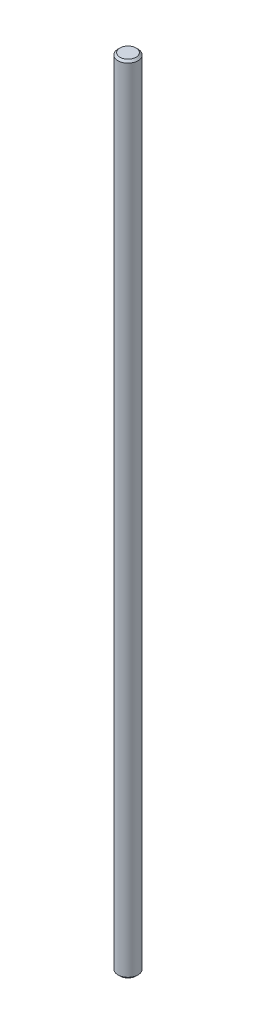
SolidWorks part; units mm, degrees
ref_plane "Front" through (0, 0, 0) normal (0, 0, 1) x (1, 0, 0)
ref_plane "Top" through (0, 0, 0) normal (0, 1, 0) x (1, 0, 0)
ref_plane "Right" through (0, 0, 0) normal (1, 0, 0) x (0, 0, -1)
sketch "Sketch1" plane through (0, 0, 0) normal (0, 1, 0) x (1, 0, 0)
  circle A0 centre (0, 0) radius 2
  dimension "D1" = 4
extrude "Extrude1" add sketch "Sketch1" along normal blind 158
chamfer "Chamfer1" distance 0.4 angle 45 2 edges at (0, 0, 2) (0, 158, 2)
